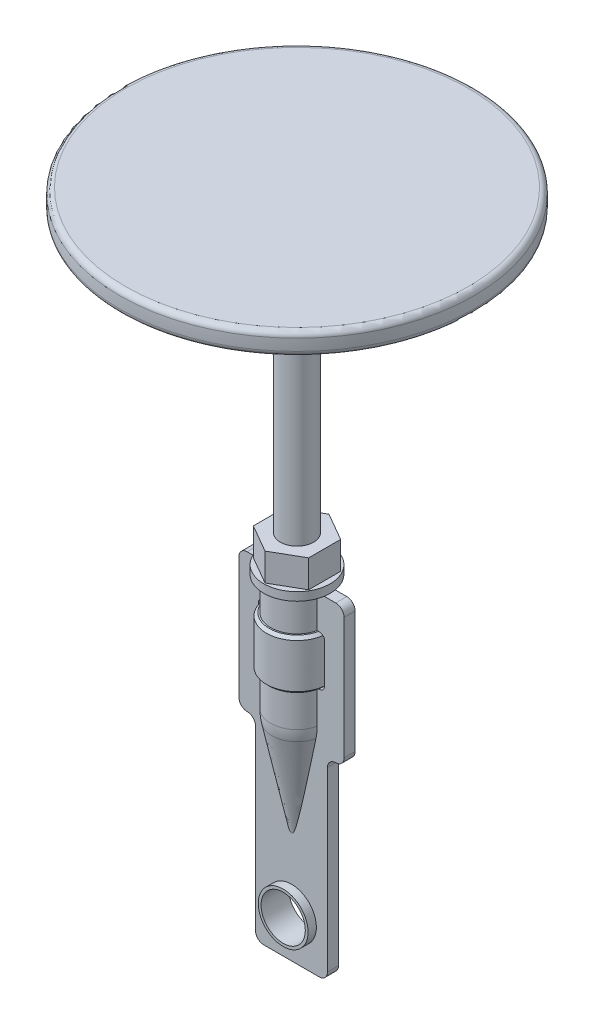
SolidWorks part; units mm, degrees
ref_plane "Plan de face" through (0, 0, 0) normal (0, 0, 1) x (1, 0, 0)
ref_plane "Plan de dessus" through (0, 0, 0) normal (0, 1, 0) x (1, 0, 0)
ref_plane "Plan de droite" through (0, 0, 0) normal (1, 0, 0) x (0, 0, -1)
sketch "Esquisse1" plane through (0, 0, 0) normal (0, 0, 1) x (1, 0, 0)
  line L1 (0, 2) -> (31.9374, 2)
  line L2 (0, 0) -> (0, 7.6104) construction
  line L3 (0, -2) -> (31.9374, -2)
  line L4 (0, 2) -> (0, -2)
  arc A1 (31.9374, -2) -> (31.9374, 2) centre (0, 0) ccw
  dimension "D1" = 32
  dimension "D2" = 4
revolve "Révolution2" add sketch "Esquisse1" angle 360 about L2
fillet "Congé1" radius 1 2 edges at (0, -2, -31.9374) (0, 2, -31.9374)
sketch "Esquisse2" plane through (0, -2, 0) normal (0, -1, 0) x (1, 0, 0)
  circle A0 centre (0, 0) radius 3
  dimension "D1" = 6
extrude "Extrusion1" add sketch "Esquisse2" along normal blind 50
sketch "Esquisse3" plane through (0, -52, 0) normal (0, -1, 0) x (1, 0, 0)
  line L1 (0, -5.7735) -> (5, -2.8868)
  line L2 (5, -2.8868) -> (5, 2.8868)
  line L3 (5, 2.8868) -> (0, 5.7735)
  line L4 (0, 5.7735) -> (-5, 2.8868)
  line L5 (-5, 2.8868) -> (-5, -2.8868)
  line L6 (-5, -2.8868) -> (0, -5.7735)
  circle A0 centre (0, 0) radius 5 construction
  dimension "D1" = 10
extrude "Extrusion2" add sketch "Esquisse3" along normal blind 5
sketch "Esquisse4" plane through (0, -57, 0) normal (0, -1, 0) x (1, 0, 0)
  circle A0 centre (0, 0) radius 6
  dimension "D1" = 12
extrude "Extrusion3" add sketch "Esquisse4" along normal blind 1.5
sketch "Esquisse5" plane through (0, 0, 0) normal (0, 0, 1) x (1, 0, 0)
  line L0 (0, -58.5) -> (0, -80.9432) construction
  line L1 (-6, -58.5) -> (6, -58.5) construction
  line L2 (0, -58.5) -> (-9.5, -58.5)
  line L3 (-9.5, -58.5) -> (-9.5, -83.5)
  line L4 (-9.5, -83.5) -> (-6.5, -83.5)
  line L5 (-6.5, -83.5) -> (-6.5, -118.5)
  line L6 (-6.5, -118.5) -> (0, -118.5)
  line L7 (0, -118.5) -> (0, -73.5)
  line L8 (0, -73.5) -> (-6, -73.5)
  line L9 (-6, -73.5) -> (-6, -64.5)
  line L10 (-6, -64.5) -> (0, -64.5)
  line L11 (0, -64.5) -> (0, -58.5)
  dimension "D1" = 9.5
  dimension "D2" = 6.5
  dimension "D3" = 25
  dimension "D4" = 35
  dimension "D5" = 6
  dimension "D6" = 9
  dimension "D7" = 6
extrude "Extrusion4" add sketch "Esquisse5" along normal mid plane 2
mirror "Symétrie1" about plane through (0, -118.5, 1) normal (-1, 0, 0) of "Extrusion4"
fillet "Congé4" radius 1.5 8 edges at (6.5, -118.5, 0) (-6.5, -118.5, 0) (9.5, -83.5, 0) (6.5, -83.5, 0) (-6.5, -83.5, 0) (-9.5, -83.5, 0) (9.5, -58.5, 0) (-9.5, -58.5, 0)
fillet "Congé5" radius 1 4 edges at (-6, -73.5, 0) (6, -73.5, 0) (6, -64.5, 0) (-6, -64.5, 0)
sketch "Esquisse6" plane through (0, 0, 0) normal (1, 0, 0) x (0, 0, -1)
  line L0 (0, -58.5) -> (0, -104.9031) construction
  line L1 (-1, -58.5) -> (1, -58.5) construction
  line L2 (0, -58.5) -> (4.75, -58.5)
  line L3 (1, -58.5) -> (6, -58.5) construction
  line L4 (4.75, -58.5) -> (4.75, -64.5)
  line L5 (4.75, -64.5) -> (5, -64.5)
  line L6 (5.5, -65) -> (5.5, -73)
  line L7 (5, -73.5) -> (4.75, -73.5)
  line L8 (4.75, -73.5) -> (4.75, -79.4694)
  line L9 (4.5398, -81.5089) -> (1, -98.5)
  line L10 (1, -85) -> (1, -117) construction
  line L11 (1, -98.5) -> (0, -98.5)
  line L12 (0, -98.5) -> (0, -58.5)
  line L13 (5, -64.5) -> (5.5, -65)
  line L14 (5.5, -73) -> (5, -73.5)
  arc A0 (4.75, -79.4694) -> (4.5398, -81.5089) centre (-5.25, -79.4694) cw
  point P10 (5.5, -64.5)
  point P11 (5.5, -73.5)
  point P25 (4.75, -80.5)
  dimension "D5" = 10
  dimension "D1" = 9.5
  dimension "D2" = 11
  dimension "D3" = 7
  dimension "D4" = 25
  dimension "D7" = 0.5
  dimension "D8" = 0.5
revolve "Révolution3" add sketch "Esquisse6" angle 360 about L0
sketch "Esquisse7" plane through (0, 0, 0) normal (0, 0, 1) x (1, 0, 0)
  line L0 (-4.6435, -58.5) -> (4.6435, -58.5) construction
  circle A0 centre (0, -111) radius 4.5
  dimension "D1" = 9
  dimension "D2" = 52.5
extrude "Extrusion5" add sketch "Esquisse7" along normal mid plane 5
sketch "Esquisse8" plane through (0, 0, 2.5) normal (0, 0, 1) x (1, 0, 0)
  circle A0 centre (0, -111) radius 4
  dimension "D1" = 8
extrude "Enlèv. mat.-Extru.1" cut sketch "Esquisse8" against normal through all
